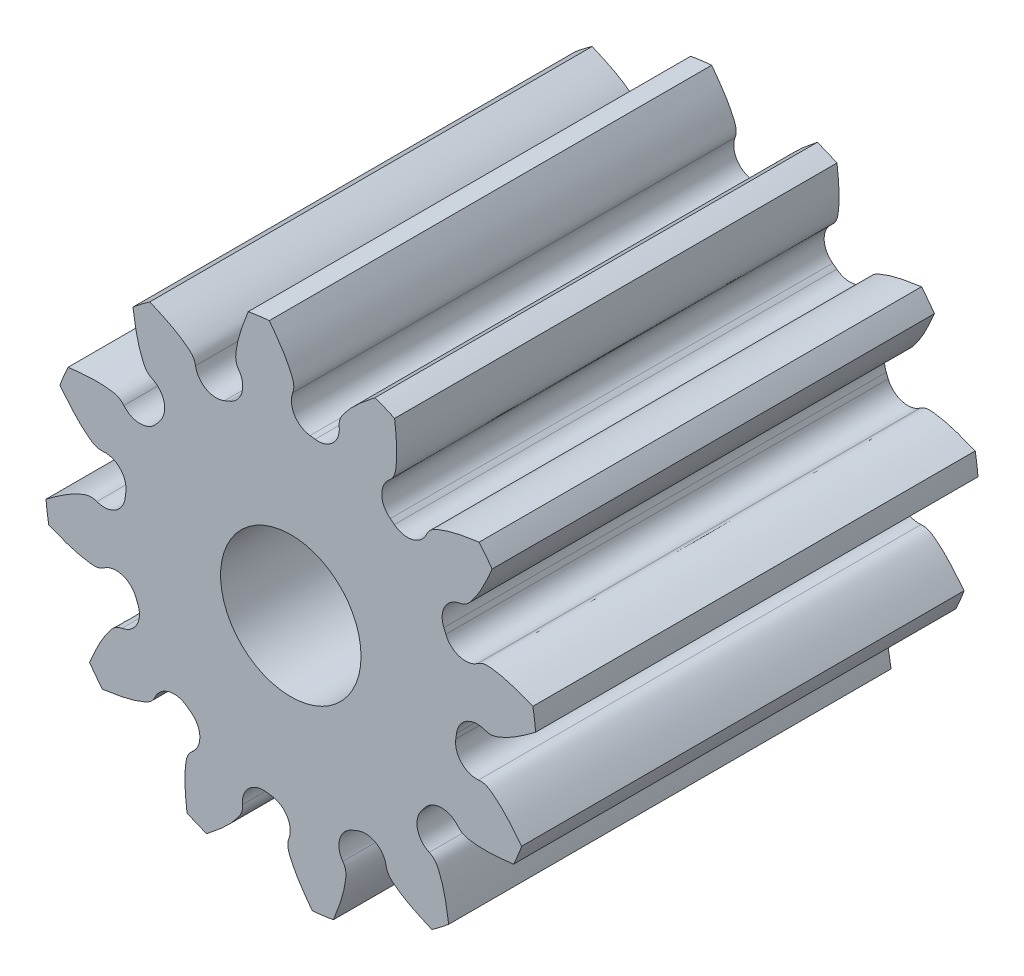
SolidWorks part; units mm, degrees
ref_plane "Plan1" through (0, 0, 0) normal (0, 0, 1) x (1, 0, 0)
ref_plane "Plan2" through (0, 0, 0) normal (0, 1, 0) x (1, 0, 0)
ref_plane "Plan3" through (0, 0, 0) normal (1, 0, 0) x (0, 0, -1)
sketch "Esquisse1" plane through (0, 0, 0) normal (0, 0, 1) x (1, 0, 0)
  circle A0 centre (0, 0) radius 2.375
  dimension "Dp" = 4.75
sketch "Esquisse2" plane through (0, 0, 0) normal (0, 0, 1) x (1, 0, 0)
  line L0 (0, 0) -> (3.4701, 0.4566) construction
  line L1 (2.8489, -0.0425) -> (2.8551, 0.3757) construction
  line L2 (0, 0) -> (2.8489, -0.0425) construction
  line L3 (0, 0) -> (3, 0) construction
  line L4 (0, 0) -> (3.4866, 0.3062) construction
  line L5 (3, 0) -> (3.4866, 0.3062) construction
  line L6 (2.6991, 0.0045) -> (2.2219, 0.3251) construction
  line L7 (2.3391, 0.4113) -> (2.3659, 0.2078)
  circle A0 centre (0, 0) radius 2.8492 construction
  circle A1 centre (0, 0) radius 3 construction
  circle A2 centre (0, 0) radius 3.5 construction
  arc A3 (3.4866, 0.3062) -> (3.4471, 0.6062) centre (0, 0) ccw
  circle A4 centre (0, 0) radius 2.375 construction
  circle A5 centre (0, 0) radius 2.375 construction
  spline S0 degree 3 poles (2.3659, 0.2078) (2.3977, 0.1947) (2.5641, 0.1262) (2.7525, -0.0956) (3.1406, 0.0491) (3.3344, 0.1931) (3.4866, 0.3062) knots 0 0 0 0 0.081432 0.426433 0.549446 1 1 1 1
  spline S1 degree 3 poles (2.3391, 0.4113) (2.3664, 0.4322) (2.5094, 0.5414) (2.6341, 0.8044) (3.0464, 0.765) (3.2708, 0.676) (3.4471, 0.6062) knots 0 0 0 0 0.081432 0.426433 0.549446 1 1 1 1
  dimension "Db" = 5.6984
  dimension "Dn" = 6
  dimension "Dt" = 7
  dimension "Tn" = 0.854
  dimension "Tt" = 5.873
  dimension "Ts" = 7.496
extrude "Base-Extrusion" add sketch "Esquisse1" along normal blind 6.3
ref_axis "Axe1" through (0, 0, -50) along (0, 0, 1)
ref_plane "Plan median" through (0, 0, 3.15) normal (0, 0, -1) x (-1, 0, 0)
extrude "Boss.-Extru.1" add sketch "Esquisse2" along normal blind 6.3
fillet "Congé1" radius 0.3 4 edges at (2.3391, 0.4113, 3.15) (2.3659, 0.2078, 3.15)
pattern_circular "Répétition circulaire1" count 12 over 360 about axis through (0, 0, -50) along (0, 0, 1) of "Boss.-Extru.1", "Congé1"
sketch "Esquisse3" plane through (0, 0, 0) normal (0, 0, 1) x (1, 0, 0)
  circle A0 centre (0, 0) radius 1
  dimension "D1" = 2
extrude "Enlèv. mat.-Extru.2" cut sketch "Esquisse3" along normal through all
sketch "Esquisse4" plane through (0, 0, 0) normal (0, 0, -1) x (-1, 0, 0)
  circle A0 centre (0, 0) radius 3 construction
  circle A1 centre (0, 0) radius 3
  circle A2 centre (0, 0) radius 1 construction
  circle A3 centre (0, 0) radius 1
extrude "Cylindre primitif" [suppressed] add sketch "Esquisse4" along normal up to surface (6.3 mm away)
ref_plane "Plan médian dent" through (0, 0, 0) normal (-0.1305, 0.9915, 0) x (-0.9915, -0.1305, 0)
ref_plane "Plan médian creux" through (0, 0, 0) normal (-0.3826, 0.9239, 0) x (-0.9239, -0.3826, 0)
equation "\"D1@Boss.-Extru.1\"=\"D1@Base-Extrusion\""
equation "\"D1@Plan median\"=\"D1@Base-Extrusion\"/2"
equation "\"D1@Plan médian creux\"=180/\"D1@Répétition circulaire1\""
